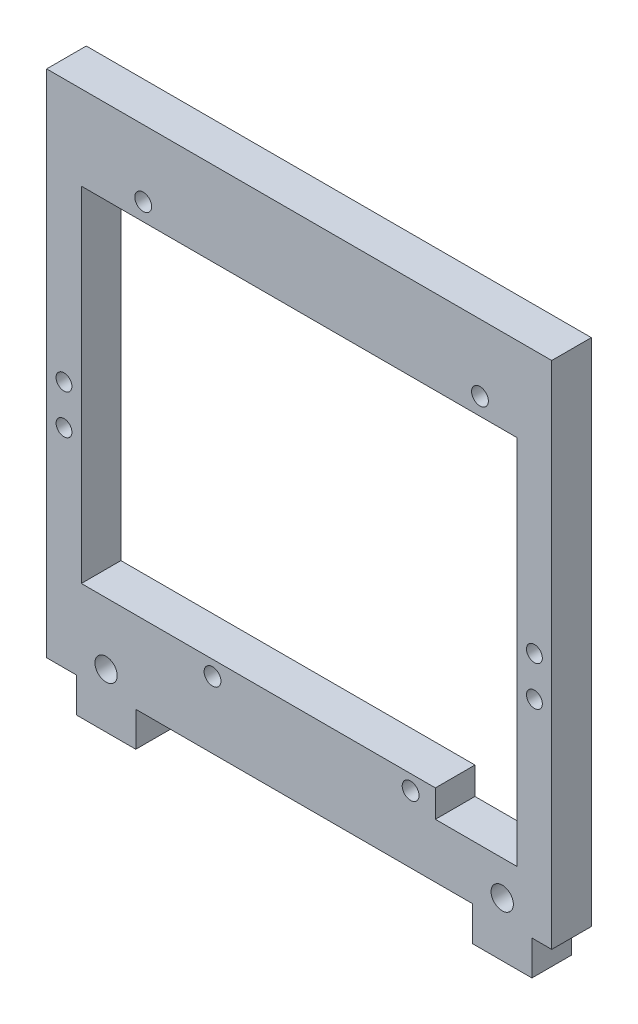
SolidWorks part; units mm, degrees
ref_plane "前视基准面" through (0, 0, 0) normal (0, 0, 1) x (1, 0, 0)
ref_plane "上视基准面" through (0, 0, 0) normal (0, 1, 0) x (1, 0, 0)
ref_plane "右视基准面" through (0, 0, 0) normal (1, 0, 0) x (0, 0, -1)
other "Configuration Table"
sketch "草图1" plane through (0, 0, 0) normal (0, 0, 1) x (1, 0, 0)
  line L0 (-52, -57) -> (-46, -57)
  line L1 (-46, -57) -> (-46, -64)
  line L2 (-46, -64) -> (-34, -64)
  line L3 (-34, -64) -> (-34, -57)
  line L4 (-34, -57) -> (34, -57)
  line L5 (34, -57) -> (34, -64)
  line L6 (34, -64) -> (46, -64)
  line L7 (46, -64) -> (46, -57)
  line L8 (46, -57) -> (50, -57)
  line L9 (50, -57) -> (50, 46)
  line L10 (50, 46) -> (-52, 46)
  line L11 (-52, 46) -> (-52, -57)
  line L12 (-45, -40.5) -> (26.5, -40.5)
  line L13 (26.5, -40.5) -> (26.5, -46)
  line L14 (26.5, -46) -> (43, -46)
  line L15 (43, -46) -> (43, 29)
  line L16 (43, 29) -> (-45, 29)
  line L17 (-45, 29) -> (-45, -40.5)
  circle A0 centre (-32.5, 32.5) radius 1.7
  circle A1 centre (35.5, 32.5) radius 1.7
  circle A2 centre (-18.5, -43.5) radius 1.7
  circle A3 centre (21.5, -43.5) radius 1.7
  circle A4 centre (-40, -53) radius 2.25
  circle A5 centre (40, -53) radius 2.25
  circle A6 centre (-48.5, -15) radius 1.6
  circle A7 centre (-48.5, -7) radius 1.6
  circle A8 centre (46.5, -15) radius 1.6
  circle A9 centre (46.5, -7) radius 1.6
  dimension "D1" = 3.2
  dimension "D2" = 4.5
  dimension "D3" = 3.4
  dimension "D4" = 21.5
  dimension "D5" = 26.5
  dimension "D6" = 34
  dimension "D7" = 35.5
  dimension "D8" = 40
  dimension "D9" = 43
  dimension "D10" = 46
  dimension "D11" = 46.5
  dimension "D12" = 50
  dimension "D13" = 18.5
  dimension "D14" = 32.5
  dimension "D15" = 34
  dimension "D16" = 40
  dimension "D17" = 45
  dimension "D18" = 48.5
  dimension "D19" = 29
  dimension "D20" = 52
  dimension "D21" = 32.5
  dimension "D22" = 46
  dimension "D23" = 7
  dimension "D24" = 15
  dimension "D25" = 40.5
  dimension "D26" = 43.5
  dimension "D27" = 46
  dimension "D28" = 53
  dimension "D29" = 57
  dimension "D30" = 64
extrude "Open_frame_M3_board_and_M4_leg_holes" add sketch "草图1" along normal blind 8
